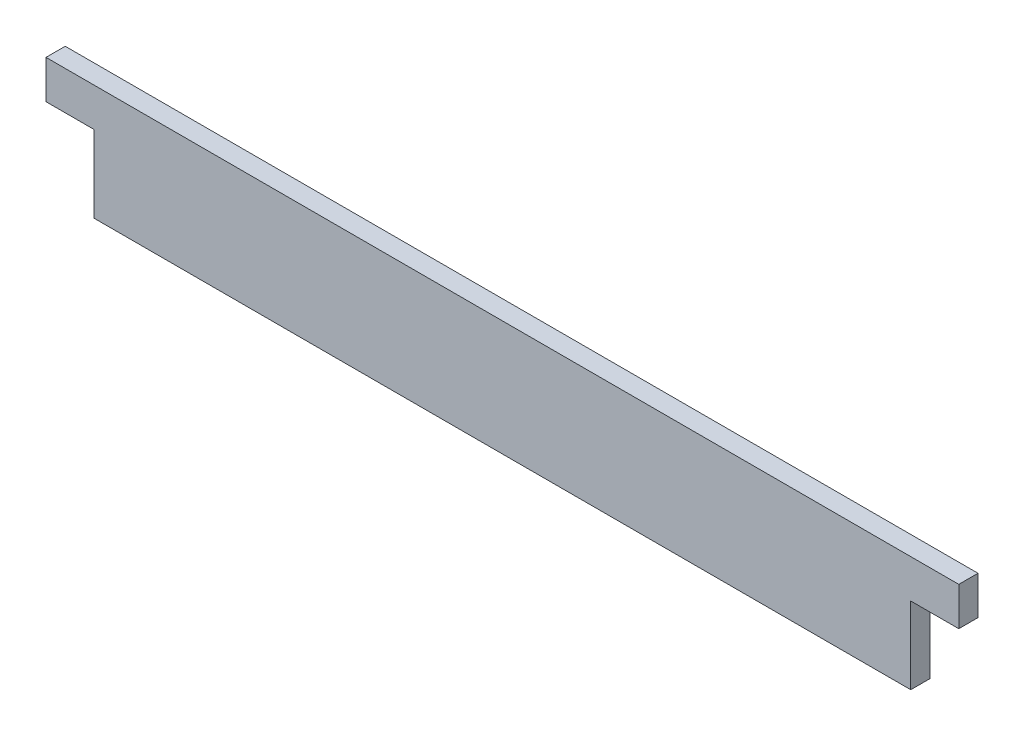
SolidWorks part; units mm, degrees
ref_plane "Face" through (0, 0, 0) normal (0, 0, 1) x (1, 0, 0)
ref_plane "Dessus" through (0, 0, 0) normal (0, 1, 0) x (1, 0, 0)
ref_plane "Droite" through (0, 0, 0) normal (1, 0, 0) x (0, 0, -1)
sketch "Esquisse1" plane through (0, 0, 0) normal (0, 0, 1) x (1, 0, 0)
  line L0 (-425, 0) -> (425, 0)
  line L1 (425, 0) -> (425, 80)
  line L2 (425, 80) -> (475, 80)
  line L3 (475, 80) -> (475, 120)
  line L4 (475, 120) -> (-475, 120)
  line L5 (-475, 120) -> (-475, 80)
  line L6 (-475, 80) -> (-425, 80)
  line L7 (-425, 80) -> (-425, 0)
  dimension "D1" = 850
  dimension "D2" = 50
  dimension "D3" = 50
  dimension "D4" = 80
  dimension "D5" = 120
  dimension "D6" = 80
extrude "Extrusion1" add sketch "Esquisse1" along normal blind 20
